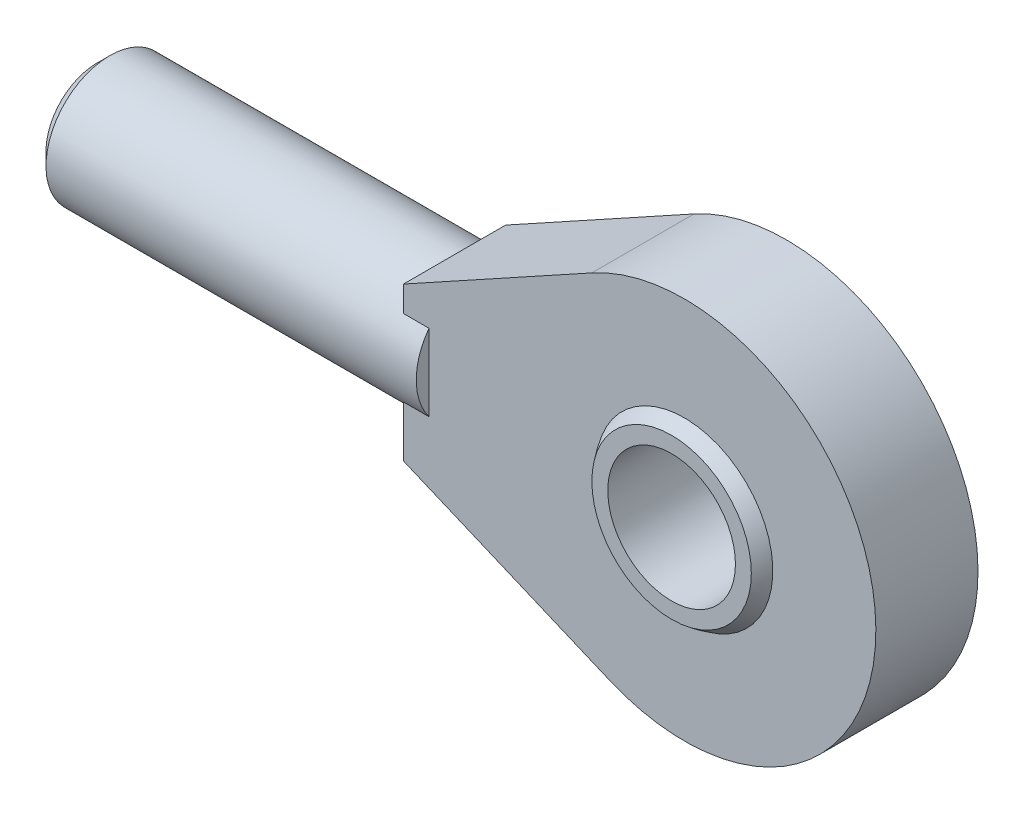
SolidWorks part; units mm, degrees
ref_plane "Face" through (0, 0, 0) normal (0, 0, 1) x (1, 0, 0)
ref_plane "Dessus" through (0, 0, 0) normal (0, 1, 0) x (1, 0, 0)
ref_plane "Droite" through (0, 0, 0) normal (1, 0, 0) x (0, 0, -1)
sketch "Esquisse2" plane through (0, 0, 0) normal (1, 0, 0) x (0, 0, -1)
  circle A0 centre (0, 0) radius 5
  dimension "D1" = 10
extrude "Base-Extrusion" add sketch "Esquisse2" along normal blind 28
sketch "Esquisse3" plane through (28, 0, 0) normal (1, 0, 0) x (0, 0, -1)
  circle A0 centre (0, 0) radius 5
  dimension "D1" = 10
extrude "Boss.-Extru.1" add sketch "Esquisse3" along normal blind 2
sketch "Esquisse6" plane through (30, 0, 0) normal (1, 0, 0) x (0, 0, -1)
  line L0 (-4, 4) -> (4, 4)
  line L1 (-4, 4) -> (-4, -4)
  line L2 (4, -4) -> (-4, -4)
  line L3 (4, -4) -> (4, 4)
  line L4 (0, 4) -> (0, -4) construction
  dimension "D1" = 8
  dimension "D2" = 8
extrude "Boss.-Extru.2" add sketch "Esquisse6" along normal blind 24
sketch "Esquisse7" plane through (0, 0, 0) normal (0, 0, 1) x (1, 0, 0)
  line L0 (30, 0) -> (0, 0) construction
  line L1 (0, 0) -> (49.528, 0) construction
  line L2 (58, 0) -> (42, 0)
  arc A0 (58, 0) -> (42, 0) centre (50, 0) ccw
  dimension "D1" = 16
  dimension "D2" = 50
revolve "Boss.-Révol.2" add sketch "Esquisse7" angle 360 about L1
sketch "Esquisse10" plane through (0, 0, 0) normal (0, 0, 1) x (1, 0, 0)
  line L0 (42.7582, 13.1361) -> (28, 5)
  line L2 (28, -7) -> (44.1702, -13.8208)
  line L3 (28, 5) -> (28, -7)
  line L4 (30, 0) -> (0, 0) construction
  line L5 (0, 5) -> (0, -5) construction
  line L6 (0, 0) -> (49.528, 0) construction
  arc A0 (44.1702, -13.8208) -> (42.7582, 13.1361) centre (50, 0) ccw
  dimension "D1" = 50
  dimension "D2" = 30
  dimension "D3" = 28
  dimension "D4" = 7
  dimension "D5" = 12
extrude "Boss.-Extru.4" add sketch "Esquisse10" along normal mid plane 8
sketch "Esquisse11" plane through (0, 0, 0) normal (0, 1, 0) x (1, 0, 0)
  line L1 (43.755, 5) -> (56.245, 5)
  line L3 (34.7306, 0) -> (66.307, 0) construction
  line L4 (30, 0) -> (0, 0) construction
  line L5 (43.755, -5) -> (56.245, -5)
  arc A1 (56.9282, 4) -> (43.0718, 4) centre (50, 0) ccw construction
  arc A2 (56.245, 5) -> (43.755, 5) centre (50, 0) ccw
  arc A3 (56.245, -5) -> (43.755, -5) centre (50, 0) cw
  dimension "D1" = 5
  dimension "D2" = 5
extrude "Enlèv. mat.-Extru.2" cut sketch "Esquisse11" against normal mid plane 16
sketch "Esquisse13" plane through (0, 0, 5) normal (0, 0, 1) x (1, 0, 0)
  circle A0 centre (50, 0) radius 5
  dimension "D1" = 10
extrude "Enlèv. mat.-Extru.3" cut sketch "Esquisse13" against normal through all
chamfer "Chanfrein4" distance 1 angle 45 1 edges at (0, 0, -5)
